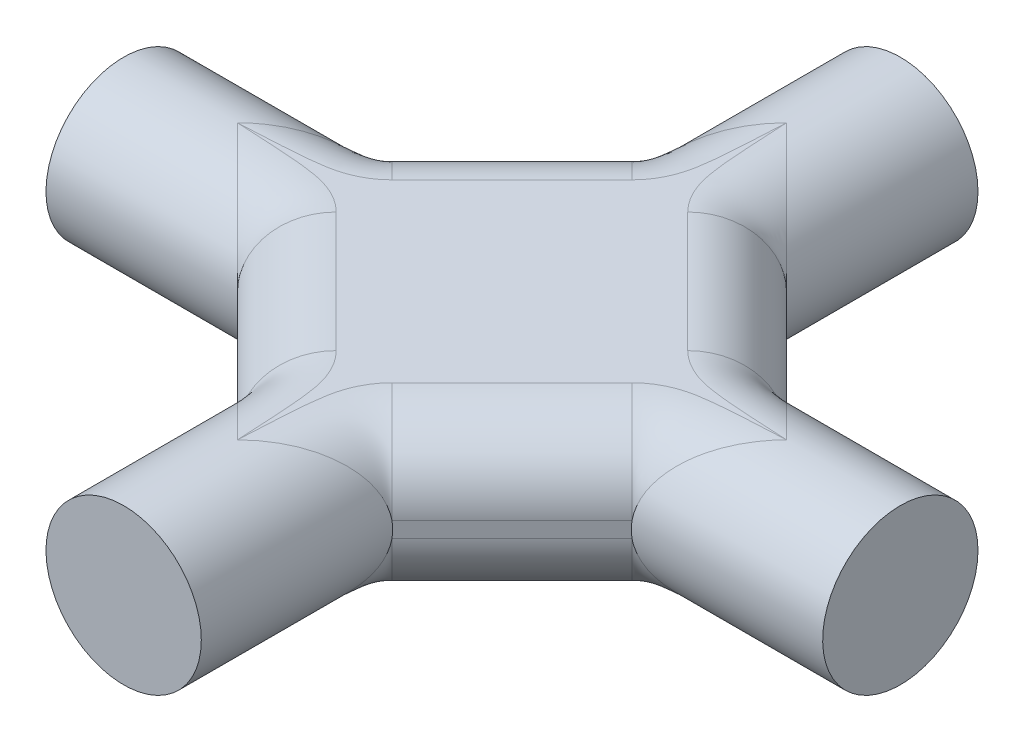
SolidWorks part; units mm, degrees
ref_plane "Face" through (0, 0, 0) normal (0, 0, 1) x (1, 0, 0)
ref_plane "Dessus" through (0, 0, 0) normal (0, 1, 0) x (1, 0, 0)
ref_plane "Droite" through (0, 0, 0) normal (1, 0, 0) x (0, 0, -1)
sketch "Esquisse1" plane through (0, 0, 0) normal (0, 0, 1) x (1, 0, 0)
  circle A0 centre (0, 0) radius 10
  dimension "D1" = 20
extrude "Extrusion1" add sketch "Esquisse1" along normal mid plane 100
sketch "Esquisse2" plane through (0, 0, 0) normal (1, 0, 0) x (0, 0, -1)
  circle A0 centre (0, 0) radius 10
  dimension "D1" = 20
extrude "Extrusion2" add sketch "Esquisse2" along normal mid plane 100
sketch "Esquisse3" plane through (0, 0, 0) normal (0, 1, 0) x (1, 0, 0)
  line L0 (0, 35.3553) -> (0, -35.3553) construction
  line L1 (0, 35.3553) -> (35.3553, 0)
  line L2 (0, 35.3553) -> (-35.3553, 0)
  line L3 (-35.3553, 0) -> (0, -35.3553)
  line L4 (35.3553, 0) -> (0, -35.3553)
  line L5 (0, 0) -> (-38.0004, 0) construction
  dimension "D1" = 50
  dimension "D2" = 50
  dimension "D3" = 90
extrude "Extrusion3" add sketch "Esquisse3" along normal mid plane 20
fillet "Congé1" radius 9
sketch "Esquisse4" plane through (0, 0, 0) normal (0, 1, 0) x (1, 0, 0)
  line L0 (-50, 0) -> (50, 0) construction
  line L1 (-50, 10) -> (-50, -10) construction
  line L2 (50, -10) -> (50, 10) construction
  line L4 (10, 50) -> (-10, 50) construction
  line L5 (0, 50) -> (0, -50) construction
  line L6 (-10, -50) -> (10, -50) construction
  point P12 (0, 0)
  point P13 (0, -40)
  point P14 (-40, 0)
  point P15 (0, 40)
  point P16 (40, 0)
  dimension "D1" = 10
  dimension "D2" = 10
  dimension "D3" = 10
  dimension "D4" = 10
